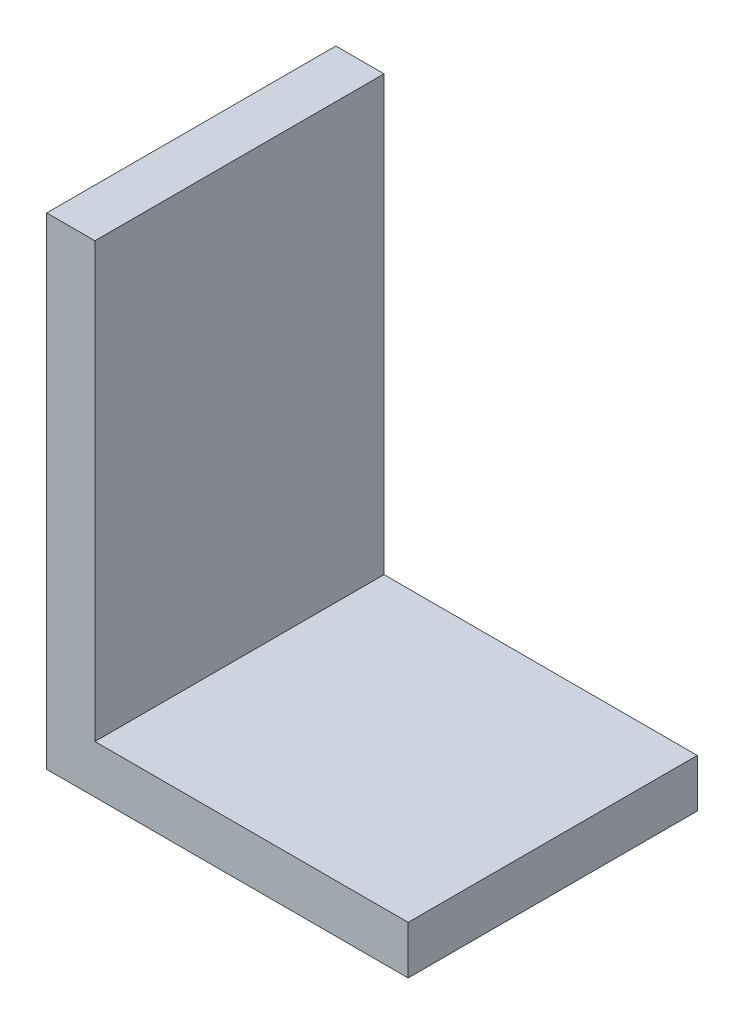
SolidWorks part; units mm, degrees
ref_plane "Front" through (0, 0, 0) normal (0, 0, 1) x (1, 0, 0)
ref_plane "Top" through (0, 0, 0) normal (0, 1, 0) x (1, 0, 0)
ref_plane "Right" through (0, 0, 0) normal (1, 0, 0) x (0, 0, -1)
sketch "Sketch1" plane through (0, 0, 0) normal (0, 0, 1) x (1, 0, 0)
  line L0 (0, 100) -> (0, 0)
  line L1 (0, 0) -> (75, 0)
  dimension "D1" = 100
  dimension "D2" = 75
extrude "Extrude-Thin1" add sketch "Sketch1" along normal mid plane 60 thin
sketch "Sketch5" plane through (0, 0, 0) normal (0, 0, 1) x (1, 0, 0)
  line L0 (10, 100) -> (75, 10)
